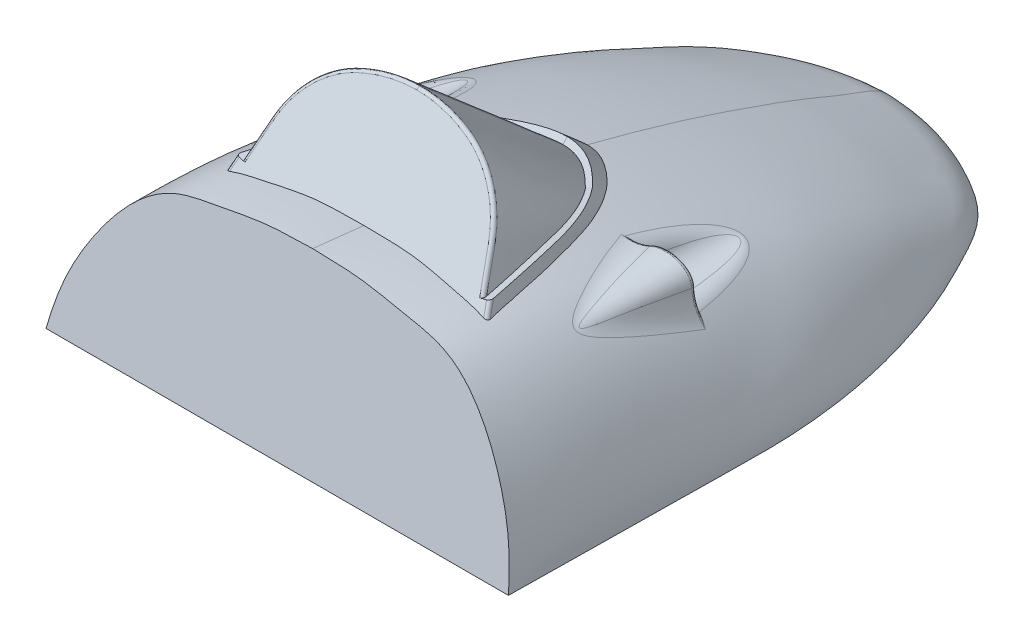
SolidWorks part; units mm, degrees
ref_plane "Front" through (0, 0, 0) normal (0, 0, 1) x (1, 0, 0)
ref_plane "Top"
ref_plane "Right" through (0, 0, 0) normal (1, 0, 0) x (0, 0, -1)
sketch "Sketch1" plane through (0, 0, 0) normal (0, 1, 0) x (1, 0, 0)
  line L0 (0, 0) -> (0, 1220)
  line L1 (0, 0) -> (-457, 0)
  line L2 (-457, 0) -> (-463.5, 482.6)
  line L3 (0, 482.6) -> (-463.5, 482.6) construction
  line L4 (0, 1118) -> (-269.1096, 1118) construction
  line L9 (0, 1220) -> (124.4514, 1220) construction
  arc A3 (0, 1220) -> (-269.1096, 1118) centre (0, 814) ccw
  arc A4 (-269.1096, 1118) -> (-292.386, 1090.5984) centre (-184.93, 1022.9064) ccw
  arc A5 (-292.386, 1090.5984) -> (-463.5, 482.6) centre (648.9806, 497.5837) ccw
  dimension "D9" = 406
  dimension "D3" = 463.5
  dimension "D6" = 127
  dimension "D4" = 1112.5815
  dimension "D1" = 457
  dimension "D2" = 1220
  dimension "D5" = 482.6
  dimension "D7" = 1118
  dimension "D8" = 90.772
sketch "Sketch2" plane through (0, 0, 0) normal (1, 0, 0) x (0, 0, -1)
  line L0 (0, 0) -> (70.1437, 330)
  line L1 (1220, 0) -> (1218.8626, 13)
  line L2 (1220, 0) -> (0, 0)
  line L4 (171.7437, 318.9435) -> (171.7437, 0)
  line L5 (966, 129.233) -> (724.2421, 207.1374) construction
  line L7 (482.6, 0) -> (482.6, 267) construction
  arc A0 (1218.8626, 13) -> (1204.0788, 33.6808) centre (1193.9578, 10.8211) ccw
  arc A4 (1204.0788, 33.6808) -> (70.1437, 330) centre (-273.999, -3304.7371) ccw
  dimension "D2" = 25
  dimension "D3" = 78
  dimension "D5" = 85
  dimension "D8" = 101.6
  dimension "D7" = 3650.9928
  dimension "D1" = 13
  dimension "D4" = 330
  dimension "D6" = 267
  dimension "D9" = 254
  dimension "D10" = 254
imported_body "Imported1"
ref_plane "Plane1" through (0, 0, -482) normal (0, 0, 1) x (1, 0, 0)
sketch "Sketch15" plane through (0, 0, -482) normal (0, 0, 1) x (1, 0, 0)
  line L0 (-292, 232) -> (-292, 270) construction
  line L1 (-292, 232) -> (-346, 232) construction
  line L2 (-437.534, 0) -> (0, 0) construction
  line L3 (0, 0) -> (0, 330.2) construction
  ellipse E0 centre (-292, 232) end of major axis (-346, 232) minor radius 38
  dimension "D1" = 232
  dimension "D2" = 292
  dimension "D3" = 108
  dimension "D4" = 76
ref_plane "Plane2" through (0, 0, -228) normal (0, 0, 1) x (1, 0, 0)
sketch "Sketch16" plane through (0, 0, -228) normal (0, 0, 1) x (1, 0, 0)
  line L0 (-292, 232) -> (-292, 270) construction
  ellipse E0 centre (-292, 232) end of major axis (-330.1, 232) minor radius 25.4
  dimension "D1" = 50.8
  dimension "D2" = 76.2
ref_plane "Plane3" through (0, 399.0782, -128.5996) normal (0, 0.9518, -0.3067) x (1, 0, 0)
loft "Boss-Loft1" add profiles "Sketch15", "Sketch16"
sketch "Sketch17" plane through (0, 0, -482) normal (0, 0, -1) x (-1, 0, 0)
  ellipse E0 centre (292, 232) end of major axis (346, 232) minor radius 38
extrude "Cut-Extrude1" cut sketch "Sketch17" along normal through all
fillet "Fillet1" radius 76 1 edges at (-320.9532, 247.7793, -276.0074)
fillet "Fillet2" radius 38 3 edges at (-268.5811, 197.7595, -647.9986)
fillet "Fillet3" radius 6.5 9 edges at (-319.0556, 249.2788, -279.2964) (-229.1196, 252.151, -482) (-354.3621, 195.5457, -482) (-230.6118, 238.8786, -482)
fillet "Fillet4" radius 3 10 edges at (-276.3928, 194.2611, -651.5235) (-265.5833, 198.8575, -641.9543) (-327.46, 199.3249, -482) (-230.6118, 238.8786, -482) (-219.4612, 247.4088, -481.6821) (-360.6934, 182.4181, -479.8992)
mirror "Boss-Mirror1"
imported_body "Surface-Imported1"
